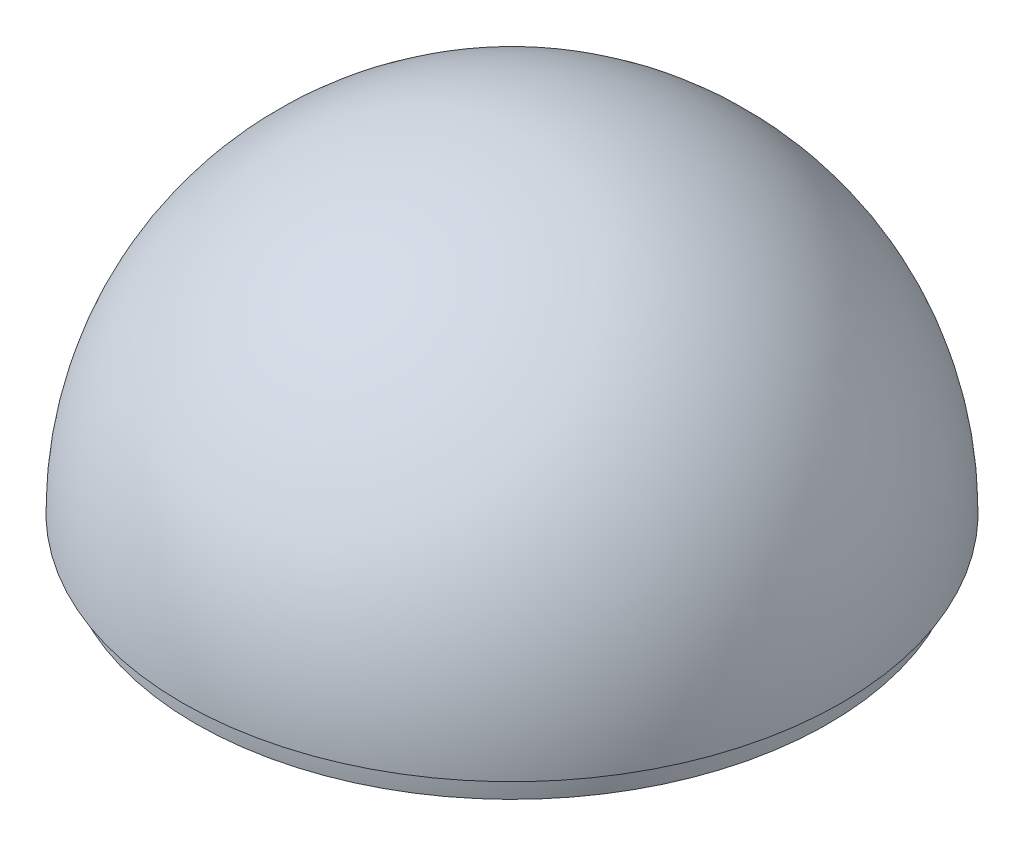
SolidWorks part; units mm, degrees
ref_plane "Face" through (0, 0, 0) normal (0, 0, 1) x (1, 0, 0)
ref_plane "Dessus" through (0, 0, 0) normal (0, 1, 0) x (1, 0, 0)
ref_plane "Droite" through (0, 0, 0) normal (1, 0, 0) x (0, 0, -1)
sketch "Esquisse1" plane through (0, 0, 0) normal (0, 0, 1) x (1, 0, 0)
  line L0 (0, 147.1049) -> (0, 51.8608) construction
  arc A0 (40, 102.0035) -> (0, 142.0035) centre (0, 102.0035) ccw
revolve "Révol.-Mince1" add sketch "Esquisse1" angle 360 about L0
sketch "Esquisse2" plane through (0, 0, 0) normal (0, 0, 1) x (1, 0, 0)
  line L0 (-40, 102.0035) -> (40, 102.0035) construction
  line L1 (37, 102.0035) -> (38.5, 102.0035)
  line L2 (37, 102.0035) -> (37, 99.0035)
  line L3 (37, 99.0035) -> (38.3829, 99.0035)
  line L6 (0, 111.941) -> (0, 56.4035) construction
  arc A0 (34.5435, 85.0035) -> (38.5, 102.0035) centre (0, 102.0035) ccw construction
  arc A1 (38.3829, 99.0035) -> (38.5, 102.0035) centre (0, 102.0035) ccw
  dimension "D1" = 3
revolve "Révolution1" add sketch "Esquisse2" angle 360 about L6
